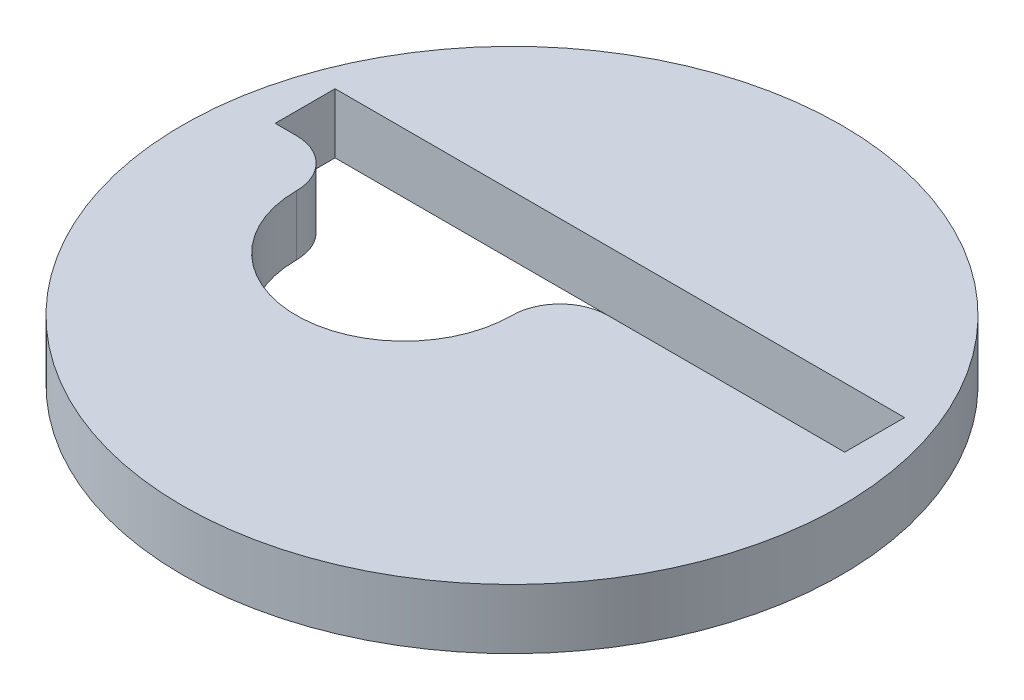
SolidWorks part; units mm, degrees
ref_plane "Front Plane" through (0, 0, 0) normal (0, 0, 1) x (1, 0, 0)
ref_plane "Top Plane" through (0, 0, 0) normal (0, 1, 0) x (1, 0, 0)
ref_plane "Right Plane" through (0, 0, 0) normal (1, 0, 0) x (0, 0, -1)
sketch "Sketch1" plane through (0, 0, 0) normal (0, 1, 0) x (1, 0, 0)
  circle A0 centre (0, 0) radius 17.4625
extrude "Boss-Extrude1" add sketch "Sketch1" along normal blind 3.175
sketch "Sketch2" plane through (0, 3.175, 0) normal (0, 1, 0) x (1, 0, 0)
  line L0 (0, 17.4625) -> (0, -17.4625) construction
  line L2 (-15.0899, 2.54) -> (15.0899, 2.54)
  line L3 (-15.0899, 2.54) -> (-15.0899, 5.715)
  line L4 (-15.0899, 5.715) -> (15.0899, 5.715)
  line L5 (15.0899, 2.54) -> (15.0899, 5.715)
  line L6 (-15.0899, 2.54) -> (15.0899, 5.715) construction
  line L7 (-15.0899, 5.715) -> (15.0899, 2.54) construction
  circle A0 centre (0, 0) radius 17.4625 construction
  point P5 (0, 4.1275)
extrude "Cut-Extrude1" cut sketch "Sketch2" against normal through all
sketch "Sketch3" plane through (0, 3.175, 0) normal (0, 1, 0) x (1, 0, 0)
  line L0 (0, 17.4625) -> (0, -17.4625) construction
  circle A0 centre (-5.715, 0) radius 5.715
  circle A1 centre (0, 0) radius 17.4625 construction
  dimension "D1" = 11.43
  dimension "D2" = 5.715
extrude "Cut-Extrude2" cut sketch "Sketch3" against normal through all
fillet "Fillet1" radius 2.54 2 edges at (-10.8345, 1.5875, -2.54) (-0.5955, 1.5875, -2.54)
sketch "Sketch4" plane through (0, 3.175, 0) normal (0, 1, 0) x (1, 0, 0)
  line L10 (14.8359, 2.794) -> (14.8359, 5.461)
  line L11 (2.54, 2.794) -> (14.8359, 2.794)
  line L16 (-14.8359, 2.794) -> (-13.97, 2.794)
  line L17 (-14.8359, 5.461) -> (-14.8359, 2.794)
  line L18 (14.8359, 5.461) -> (-14.8359, 5.461)
  line L19 (14.8359, 2.794) -> (14.8359, 5.461)
  line L20 (2.54, 2.794) -> (14.8359, 2.794)
  line L21 (-14.8359, 2.794) -> (-13.97, 2.794)
  line L22 (-14.8359, 5.461) -> (-14.8359, 2.794)
  line L23 (14.8359, 5.461) -> (-14.8359, 5.461)
  circle A2 centre (0, 0) radius 17.7165
  circle A3 centre (0, 0) radius 17.7165
  arc A8 (2.54, 2.794) -> (-0.254, 0) centre (2.54, 0) ccw
  arc A9 (-11.176, 0) -> (-0.254, 0) centre (-5.715, 0) ccw
  arc A10 (-11.176, 0) -> (-13.97, 2.794) centre (-13.97, 0) ccw
  arc A11 (2.54, 2.794) -> (-0.254, 0) centre (2.54, 0) ccw
  arc A15 (-11.176, 0) -> (-0.254, 0) centre (-5.715, 0) ccw
  arc A16 (-11.176, 0) -> (-13.97, 2.794) centre (-13.97, 0) ccw
  dimension "D1" = 0.254
  dimension "D2" = 0.254
equation "\"t\"= .125in"
equation "\"Db\"= 1.40in"
equation "\"dc\"= .1in"
equation "\"ce\"= .04in"
equation "\"BaseDiameter@Sketch1\"= \"Dt\""
equation "\"DistFromCenter@Sketch2\" = \"dc\""
equation "\"D1@Boss-Extrude1\"= \"t\""
equation "\"Thickness@Sketch2\"= \"t\""
equation "\"UprightWidth@Sketch2\"= 2 * sqr ( ( \"Db\" / 2 - \"ce\" ) ^ 2 - ( \"dc\" + 1.5 * \"t\" ) ^ 2 )"
equation "\"Dm\"= 1.51in"
equation "\"Dt\"= 1.375in"
